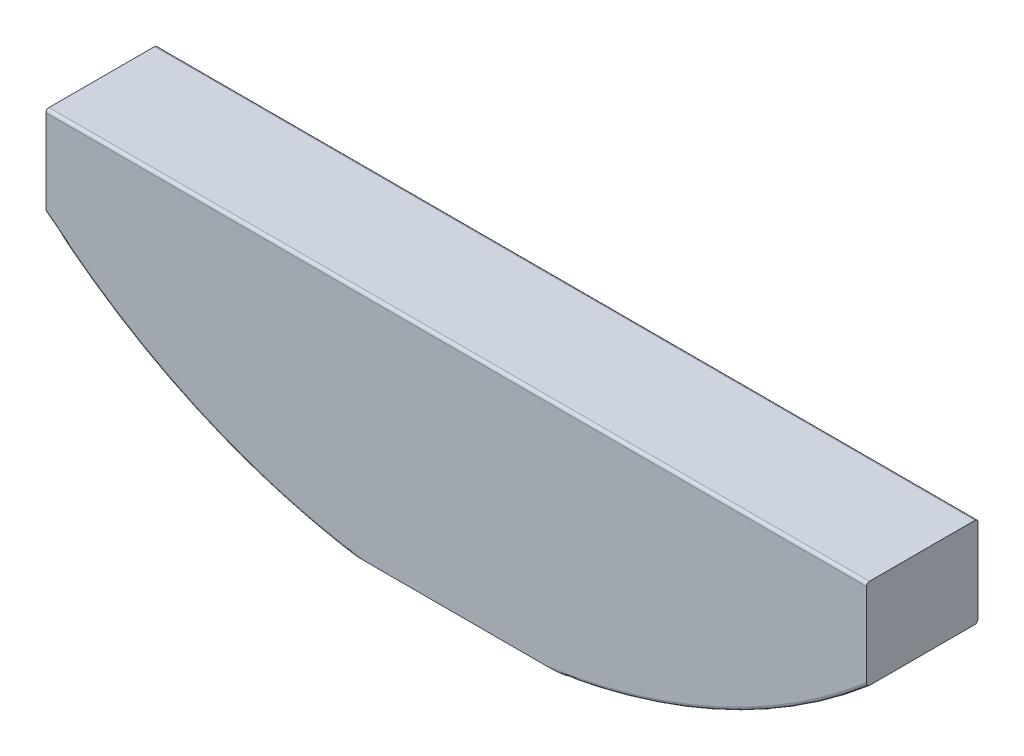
SolidWorks part; units mm, degrees
ref_plane "Front Plane" through (0, 0, 0) normal (0, 0, 1) x (1, 0, 0)
ref_plane "Top Plane" through (0, 0, 0) normal (0, 1, 0) x (1, 0, 0)
ref_plane "Right Plane" through (0, 0, 0) normal (1, 0, 0) x (0, 0, -1)
other "Configuration Table"
sketch "Sketch1" plane through (0, 0, 0) normal (0, 0, 1) x (1, 0, 0)
  line L0 (-73.722, 0) -> (74.6512, 0) construction
  line L1 (-21.2245, -16.6687) -> (21.2245, -16.6687)
  arc A0 (-21.2245, -16.6687) -> (21.2245, -16.6687) centre (0, 0) ccw
  dimension "Breadth" = 53.975
  dimension "Excursion" = 16.6687
extrude "Extrude1" add sketch "Sketch1" along normal blind 4.7625
fillet "Fillet3" radius 0.127 6 edges at (-21.2245, -16.6687, 2.3813) (21.2245, -16.6687, 2.3813) (0, -16.6687, 4.7625) (0, -26.9875, 4.7625) (0, -16.6687, 0) (0, -26.9875, 0)
sketch "Sketch3" plane through (0, 0, 0) normal (0, 0, 1) x (1, 0, 0)
  line L0 (-50.8, -26.5748) -> (50.8, -26.5748)
  line L2 (-20.9616, -16.6687) -> (20.9616, -16.6687) construction
  dimension "D1" = 50.8
  dimension "D2" = 101.6
  dimension "High" = 9.906
extrude "Cut-Extrude2" cut sketch "Sketch3" along normal through all and the other way through all flip side to cut
sketch "Sketch2" plane through (0, 0, 0) normal (0, 0, 1) x (1, 0, 0)
  line L0 (-17.526, 0) -> (-17.526, -50.8)
  line L1 (0, 0) -> (0, -50.8) construction
  dimension "D1" = 50.8
  dimension "Length" = 35.052
extrude "Cut-Extrude1" cut sketch "Sketch2" against normal through all and the other way through all flip side to cut
mirror "Mirror1" about plane through (0, 0, 0) normal (1, 0, 0) of "Cut-Extrude1"
equation "\"Radius@Fillet3\" = \"Width@Extrude1\"*2/75"
